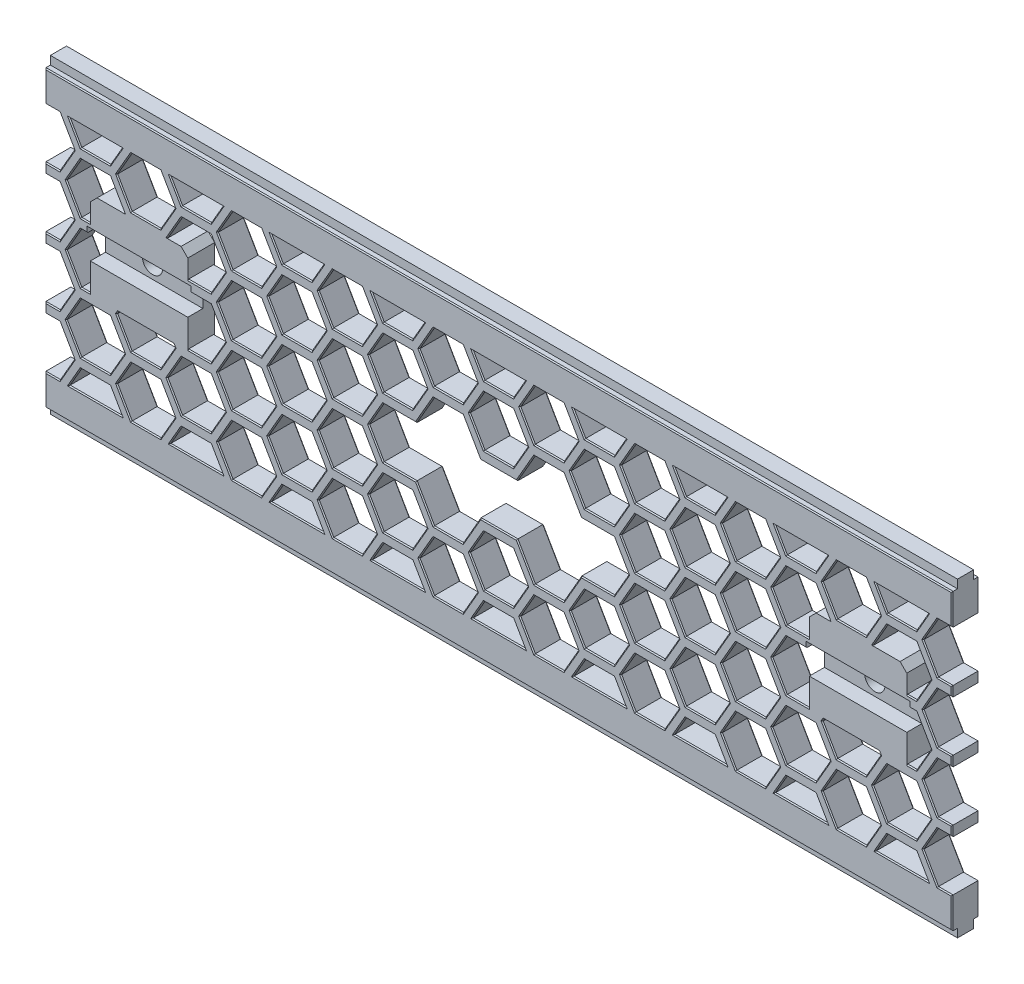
SolidWorks part; units mm, degrees
ref_plane "Aufriss" through (0, 0, 0) normal (0, 0, 1) x (1, 0, 0)
ref_plane "Grundriss" through (0, 0, 0) normal (0, 1, 0) x (1, 0, 0)
ref_plane "Seitenriss" through (0, 0, 0) normal (1, 0, 0) x (0, 0, -1)
sketch "Skizze1" plane through (0, 0, 0) normal (0, 0, 1) x (1, 0, 0)
  line L1 (-395, -43.75) -> (395, -43.75)
  line L2 (-395, -43.75) -> (-395, 43.75)
  line L3 (-395, 43.75) -> (395, 43.75)
  line L4 (395, -43.75) -> (395, 43.75)
  line L5 (-395, -43.75) -> (395, 43.75) construction
  line L6 (-395, 43.75) -> (395, -43.75) construction
  point P0 (0, 0)
  dimension "D1" = 790
  dimension "D2" = 87.5
extrude "Aufsatz-Linear austragen1" add sketch "Skizze1" along normal mid plane 8
sketch "Skizze2" plane through (0, 0, 4) normal (0, 0, 1) x (1, 0, 0)
  line L0 (-395, 43.75) -> (-395, -43.75) construction
  line L1 (-370.6699, 34.5) -> (-379.3301, 34.5)
  line L2 (-379.3301, 34.5) -> (-383.6603, 27)
  line L3 (-383.6603, 27) -> (-379.3301, 19.5)
  line L4 (-379.3301, 19.5) -> (-370.6699, 19.5)
  line L5 (-370.6699, 19.5) -> (-366.3397, 27)
  line L6 (-366.3397, 27) -> (-370.6699, 34.5)
  line L7 (395, 43.75) -> (-395, 43.75) construction
  circle A0 centre (-375, 27) radius 7.5 construction
  dimension "D1" = 20
  dimension "D2" = 16.75
  dimension "D3" = 15
extrude "Schnitt-Linear austragen1" cut sketch "Skizze2" against normal through all
pattern_linear "Lineares Muster1" count 26 spacing 30 along (1, 0, 0) count 4 spacing 18 along (0, -1, 0) of "Schnitt-Linear austragen1"
sketch "Skizze3" plane through (0, 0, 4) normal (0, 0, 1) x (1, 0, 0)
  line L0 (-370.6699, 34.5) -> (-379.3301, 34.5) construction
  line L1 (-364.3301, 25.5) -> (-368.6603, 18)
  line L2 (-368.6603, 18) -> (-364.3301, 10.5)
  line L3 (-364.3301, 10.5) -> (-355.6699, 10.5)
  line L4 (-355.6699, 10.5) -> (-351.3397, 18)
  line L5 (-351.3397, 18) -> (-355.6699, 25.5)
  line L6 (-355.6699, 25.5) -> (-364.3301, 25.5)
  line L7 (-395, 43.75) -> (-395, -43.75) construction
  line L8 (395, 43.75) -> (-395, 43.75) construction
  circle A0 centre (-360, 18) radius 7.5 construction
  dimension "D1" = 35
  dimension "D2" = 25.75
extrude "Schnitt-Linear austragen2" cut sketch "Skizze3" against normal through all
pattern_linear "Lineares Muster2" count 25 spacing 30 along (1, 0, 0) count 4 spacing 18 along (0, -1, 0) of "Schnitt-Linear austragen2"
pattern_linear "Lineares Muster3" count 2 spacing 18 along (0, 1, 0) count 25 spacing 30 along (1, 0, 0) of "Schnitt-Linear austragen2"
sketch "Skizze4" plane through (0, 0, 4) normal (0, 0, 1) x (1, 0, 0)
  line L0 (395, -43.75) -> (395, 43.75) construction
  line L1 (-395, 43.75) -> (395, 43.75)
  line L3 (-395, 34.5) -> (395, 34.5)
  line L4 (395, 43.75) -> (395, 34.5)
  line L5 (-395, 43.75) -> (-395, -43.75) construction
  line L6 (395, -43.75) -> (-395, -43.75)
  line L7 (395, -43.75) -> (395, -34.5)
  line L8 (395, -34.5) -> (-395, -34.5)
  line L9 (-395, -43.75) -> (-395, -34.5)
  line L11 (-379.3301, -34.5) -> (-370.6699, -34.5) construction
  line L12 (-370.6699, 34.5) -> (-379.3301, 34.5) construction
  line L14 (-395, 34.5) -> (-395, 43.75)
extrude "Aufsatz-Linear austragen2" add sketch "Skizze4" against normal up to surface (8 mm away)
sketch "Skizze5" plane through (0, 0, 0) normal (0, 0, 1) x (1, 0, 0)
  line L1 (-395, 43.75) -> (395, 43.75)
  line L2 (-395, 43.75) -> (-395, -43.75)
  line L3 (-395, -43.75) -> (395, -43.75)
  line L4 (395, 43.75) -> (395, -43.75)
  line L5 (-397.5, 46.25) -> (397.5, 46.25)
  line L6 (-397.5, 46.25) -> (-397.5, -46.25)
  line L7 (-397.5, -46.25) -> (397.5, -46.25)
  line L8 (397.5, 46.25) -> (397.5, -46.25)
  dimension "D1" = 2.5
  dimension "D2" = 2.5
  dimension "D3" = 2.5
  dimension "D4" = 2.5
extrude "Aufsatz-Linear austragen3" add sketch "Skizze5" along normal mid plane 4.8
sketch "Skizze6" plane through (0, 0, 4) normal (0, 0, 1) x (1, 0, 0)
  line L0 (397.5, 46.25) -> (-397.5, 46.25) construction
  line L1 (135, -46.25) -> (397.5, -46.25)
  line L2 (-135, -46.25) -> (-135, 46.25)
  line L3 (135, 46.25) -> (397.5, 46.25)
  line L4 (397.5, -46.25) -> (397.5, 46.25)
  line L5 (135, 46.25) -> (135, -46.25)
  line L6 (-135, 46.25) -> (-397.5, 46.25)
  line L7 (-397.5, 46.25) -> (-397.5, -46.25)
  line L8 (-130.6699, 34.5) -> (-139.3301, 34.5) construction
  line L9 (-397.5, -46.25) -> (-135, -46.25)
  point P0 (0, 0)
  point P10 (-135, 34.5)
  dimension "D1" = 135
  dimension "D2" = 135
extrude "Schnitt-Linear austragen3" cut sketch "Skizze6" against normal through all both and the other way through all
sketch "Skizze12" plane through (0, 0, 4) normal (0, 0, 1) x (1, 0, 0)
  line L0 (-23.6603, 9) -> (-24.5263, 7.5)
  line L1 (-25.6699, 7.5) -> (-24.5263, 7.5)
  line L2 (-25.6699, 7.5) -> (-25.6699, -7.5)
  line L3 (-25.6699, -7.5) -> (-24.5263, -7.5)
  line L4 (25.6699, 7.5) -> (25.6699, -7.5)
  line L5 (-23.6603, -9) -> (-24.5263, -7.5)
  line L6 (-6.3397, -9) -> (-5.4737, -7.5)
  line L7 (-23.6603, -9) -> (-6.3397, -9)
  line L8 (5.4737, -7.5) -> (6.3397, -9)
  line L9 (6.3397, -9) -> (23.6603, -9)
  line L10 (23.6603, -9) -> (24.5263, -7.5)
  line L11 (19.3301, -16.5) -> (23.6603, -9) construction
  line L12 (6.3397, -9) -> (10.6699, -16.5) construction
  line L13 (-10.6699, -16.5) -> (-6.3397, -9) construction
  line L14 (-23.6603, -9) -> (-19.3301, -16.5) construction
  line L15 (-23.6603, 9) -> (-6.3397, 9)
  line L16 (-6.3397, 9) -> (-5.4737, 7.5)
  line L17 (5.4737, 7.5) -> (6.3397, 9)
  line L18 (6.3397, 9) -> (23.6603, 9)
  line L19 (23.6603, 9) -> (24.5263, 7.5)
  line L20 (23.6603, 9) -> (19.3301, 16.5) construction
  line L21 (10.6699, 16.5) -> (6.3397, 9) construction
  line L22 (-6.3397, 9) -> (-10.6699, 16.5) construction
  line L23 (-19.3301, 16.5) -> (-23.6603, 9) construction
  line L24 (-5.4737, 7.5) -> (5.4737, 7.5)
  line L25 (-5.4737, -7.5) -> (5.4737, -7.5)
  line L26 (24.5263, -7.5) -> (25.6699, -7.5)
  line L27 (24.5263, 7.5) -> (25.6699, 7.5)
extrude "Schnitt-Linear austragen5" cut sketch "Skizze12" against normal through all
chamfer "Fase1" distance 0.3 angle 45
sketch "Skizze7" plane through (0, 0, 4) normal (0, 0, 1) x (1, 0, 0)
  line L0 (135, 46.25) -> (-135, 46.25) construction
  line L1 (-121.5, 18.05) -> (-92.5, 18.05)
  line L2 (-121.5, 18.05) -> (-121.5, -7.95)
  line L3 (-121.5, -7.95) -> (-92.5, -7.95)
  line L4 (-92.5, 18.05) -> (-92.5, -7.95)
  line L5 (92.5, 18.05) -> (121.5, 18.05)
  line L6 (92.5, 18.05) -> (92.5, -7.95)
  line L7 (92.5, -7.95) -> (121.5, -7.95)
  line L8 (121.5, 18.05) -> (121.5, -7.95)
  point P8 (-107, 18.05)
  point P10 (107, 18.05)
  dimension "D1" = 29
  dimension "D2" = 26
  dimension "D3" = 107
  dimension "D4" = 107
  dimension "D5" = 28.2
extrude "Aufsatz-Linear austragen4" add sketch "Skizze7" against normal up to surface (8 mm away)
sketch "Skizze8" plane through (0, 0, 4) normal (0, 0, 1) x (1, 0, 0)
  line L0 (-121.5, 34.8) -> (-121.5, 28.2) construction
  line L1 (-121.5, 9.3) -> (-92.5, 9.3)
  line L2 (-121.5, 9.3) -> (-121.5, 0.8)
  line L3 (-121.5, 0.8) -> (-92.5, 0.8)
  line L4 (-92.5, 9.3) -> (-92.5, 0.8)
  line L5 (-92.5, -7.95) -> (-92.5, 25.8) construction
  line L6 (92.5, 34.8) -> (92.5, 28.2) construction
  line L7 (92.5, 9.3) -> (121.5, 9.3)
  line L8 (92.5, 9.3) -> (92.5, 0.8)
  line L9 (92.5, 0.8) -> (121.5, 0.8)
  line L10 (121.5, 9.3) -> (121.5, 0.8)
  line L11 (121.5, -7.95) -> (121.5, 25.8) construction
  line L12 (-113.4004, -7.95) -> (-96.5996, -7.95) construction
  point P16 (-121.5, 5.05)
  dimension "D1" = 8.5
  dimension "D2" = 13
extrude "Schnitt-Linear austragen4" cut sketch "Skizze8" against normal blind 4.5
hole_wizard "Ø6.0 (6) Durchmesser Bohrung1" positions "Skizze9" profile "Skizze10" hole size "Ø6.0" standard "DIN"
sketch "Skizze9" plane through (0, 0, -0.5) normal (0, 0, 1) x (1, 0, 0)
  line L6 (-92.5, -7.8) -> (-92.5, 0.8) construction
  line L8 (92.5, 7.5) -> (92.5, 0.8) construction
  line L9 (-121.5, 0.8) -> (-92.5, 0.8) construction
  point P0 (-107.5, 5.05)
  point P2 (107.5, 5.05)
  dimension "D1" = 15
  dimension "D2" = 15
  dimension "D3" = 4.25
sketch "Skizze10" plane through (-107.5, 5.05, -0.5) normal (1, 0, 0) x (0, -1, 0)
  line L0 (0, 0) -> (0, 3.5)
  line L1 (0, 3.5) -> (3, 3.5)
  line L2 (3, 3.5) -> (3, 0)
  line L5 (3, 0) -> (0, 0)
  line L11 (0, -6.35) -> (0, 107.95) construction
  dimension "Bohrerdurchmesser" = 6
  dimension "Bohrungstiefe" = 3.5
chamfer "Fase2" distance 2 angle 45 4 edges at (92.5, 18.05, 0) (121.5, 18.05, 0) (-92.5, 18.05, 0) (-121.5, 18.05, 0)
sketch "Skizze13" plane through (0, 0, -0.5) normal (0, 0, 1) x (1, 0, 0)
  line L0 (92.5, 7.5) -> (85.6699, 7.5) construction
  line L1 (91.5, 7.5) -> (122.5, 7.5)
  line L2 (91.5, 7.5) -> (91.5, 9.3)
  line L3 (91.5, 9.3) -> (122.5, 9.3)
  line L4 (122.5, 7.5) -> (122.5, 9.3)
  line L5 (121.5, 9.3) -> (92.5, 9.3) construction
  line L6 (121.5, 7.8) -> (121.5, 9.3) construction
  line L7 (92.5, 9.3) -> (92.5, 7.8) construction
  line L8 (-92.5, 9.3) -> (-121.5, 9.3) construction
  line L9 (-122.5, 9.3) -> (-91.5, 9.3)
  line L10 (-122.5, 9.3) -> (-122.5, 7.5)
  line L11 (-122.5, 7.5) -> (-91.5, 7.5)
  line L12 (-91.5, 9.3) -> (-91.5, 7.5)
  line L13 (-121.5, 7.5) -> (-124.3301, 7.5) construction
  line L14 (-121.5, 0.8) -> (-121.5, 7.5) construction
  line L15 (-92.5, 0.8) -> (-92.5, 7.5) construction
  dimension "D1" = 1
  dimension "D2" = 1
  dimension "D3" = 1
  dimension "D4" = 1
extrude "Schnitt-Linear austragen6" cut sketch "Skizze13" along normal through all
